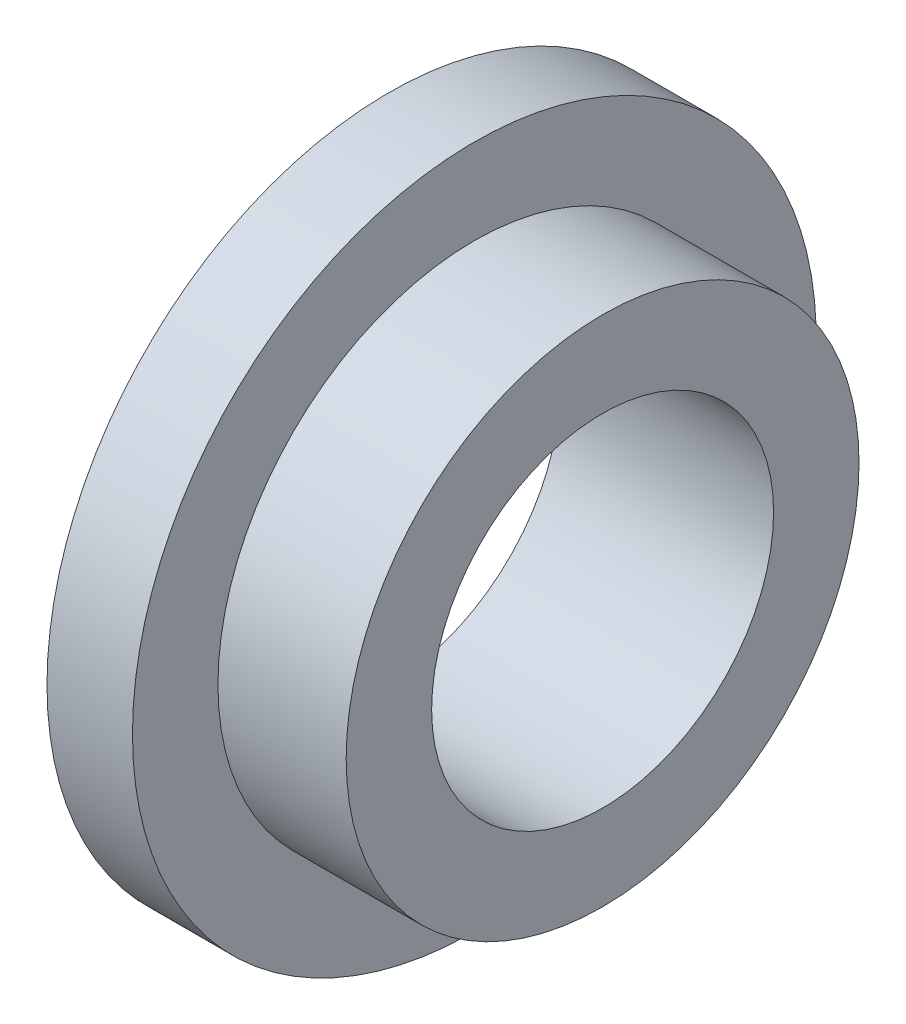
SolidWorks part; units mm, degrees
ref_plane "Front Plane" through (0, 0, 0) normal (0, 0, 1) x (1, 0, 0)
ref_plane "Top Plane" through (0, 0, 0) normal (0, 1, 0) x (1, 0, 0)
ref_plane "Right Plane" through (0, 0, 0) normal (1, 0, 0) x (0, 0, -1)
sketch "Sketch1" plane through (0, 0, 0) normal (0, 0, 1) x (1, 0, 0)
  line L0 (0, 0) -> (31.6771, 0) construction
  line L1 (0, 8) -> (0, 4)
  line L2 (0, 4) -> (5, 4)
  line L3 (5, 4) -> (5, 6)
  line L4 (5, 6) -> (2, 6)
  line L5 (2, 6) -> (2, 8)
  line L6 (2, 8) -> (0, 8)
  dimension "D1" = 8
  dimension "D2" = 16
  dimension "D3" = 2
  dimension "D4" = 5
  dimension "D5" = 12
revolve "Revolve1" add sketch "Sketch1" angle 360 about L0
